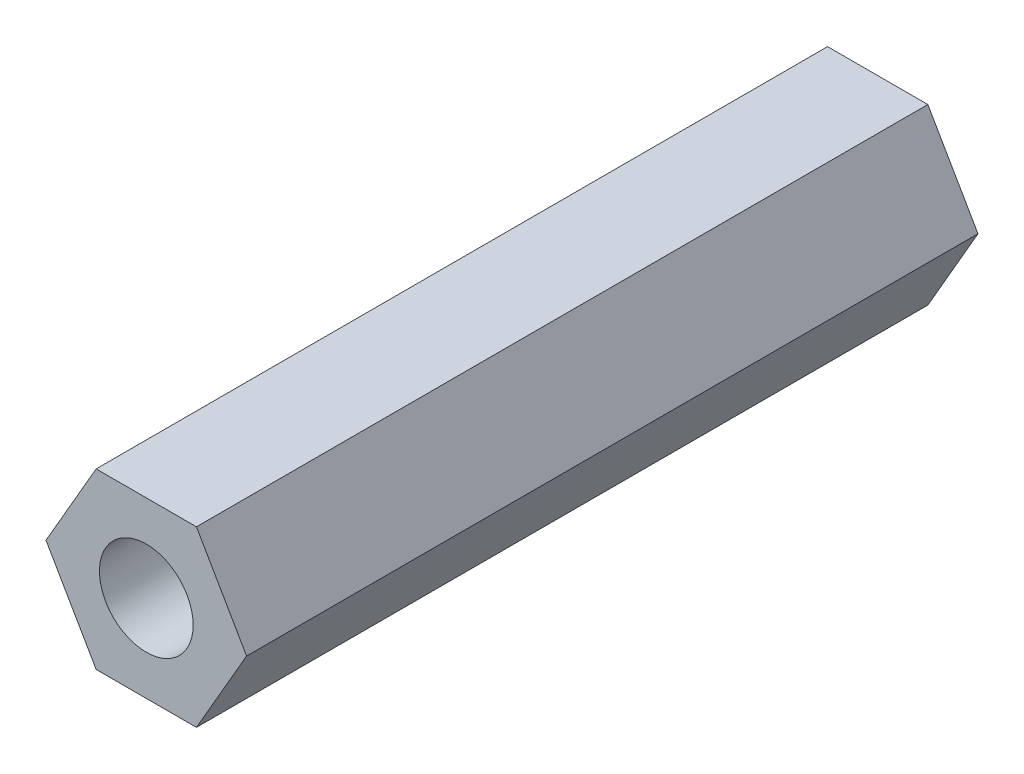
SolidWorks part; units mm, degrees
ref_plane "Plan1" through (0, 0, 0) normal (0, 0, 1) x (1, 0, 0)
ref_plane "Plan2" through (0, 0, 0) normal (0, 1, 0) x (1, 0, 0)
ref_plane "Plan3" through (0, 0, 0) normal (1, 0, 0) x (0, 0, -1)
sketch "Esquisse1" plane through (0, 0, 0) normal (0, 0, 1) x (1, 0, 0)
  line L1 (5.4848, -9.5) -> (10.9697, 0)
  line L2 (10.9697, 0) -> (5.4848, 9.5)
  line L3 (5.4848, 9.5) -> (-5.4848, 9.5)
  line L4 (-5.4848, 9.5) -> (-10.9697, 0)
  line L5 (-10.9697, 0) -> (-5.4848, -9.5)
  line L6 (-5.4848, -9.5) -> (5.4848, -9.5)
  circle A0 centre (0, 0) radius 9.5 construction
  circle A1 centre (0, 0) radius 5.125
  dimension "D2" = 10.25
  dimension "D1" = 19
extrude "Base-Extrusion" add sketch "Esquisse1" along normal blind 80
